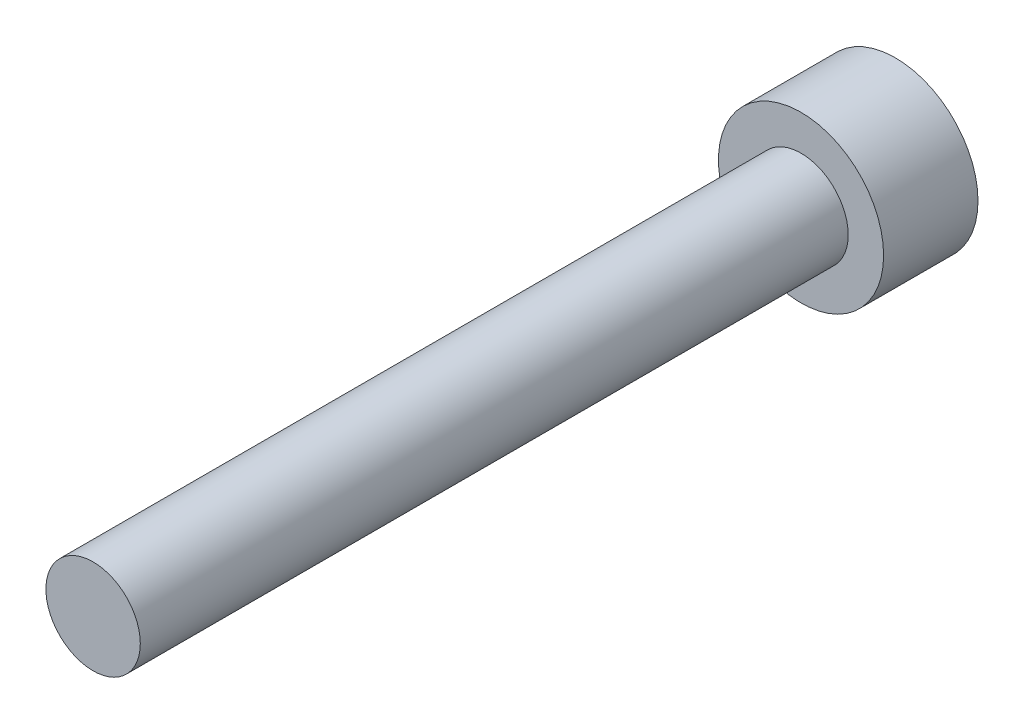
SolidWorks part; units mm, degrees
ref_plane "前视基准面" through (0, 0, 0) normal (0, 0, 1) x (1, 0, 0)
ref_plane "上视基准面" through (0, 0, 0) normal (0, 1, 0) x (1, 0, 0)
ref_plane "右视基准面" through (0, 0, 0) normal (1, 0, 0) x (0, 0, -1)
other "Configuration Table"
sketch "草图1" plane through (0, 0, 0) normal (0, 0, 1) x (1, 0, 0)
  circle A0 centre (0, 0) radius 3.5
  dimension "D1" = 7
extrude "Head_envelope" add sketch "草图1" along normal blind 4 from offset 4
sketch "草图2" plane through (0, 0, 0) normal (0, 0, 1) x (1, 0, 0)
  circle A0 centre (0, 0) radius 2
  dimension "D1" = 4
extrude "Shank_envelope_no_threads" add sketch "草图2" along normal blind 30
